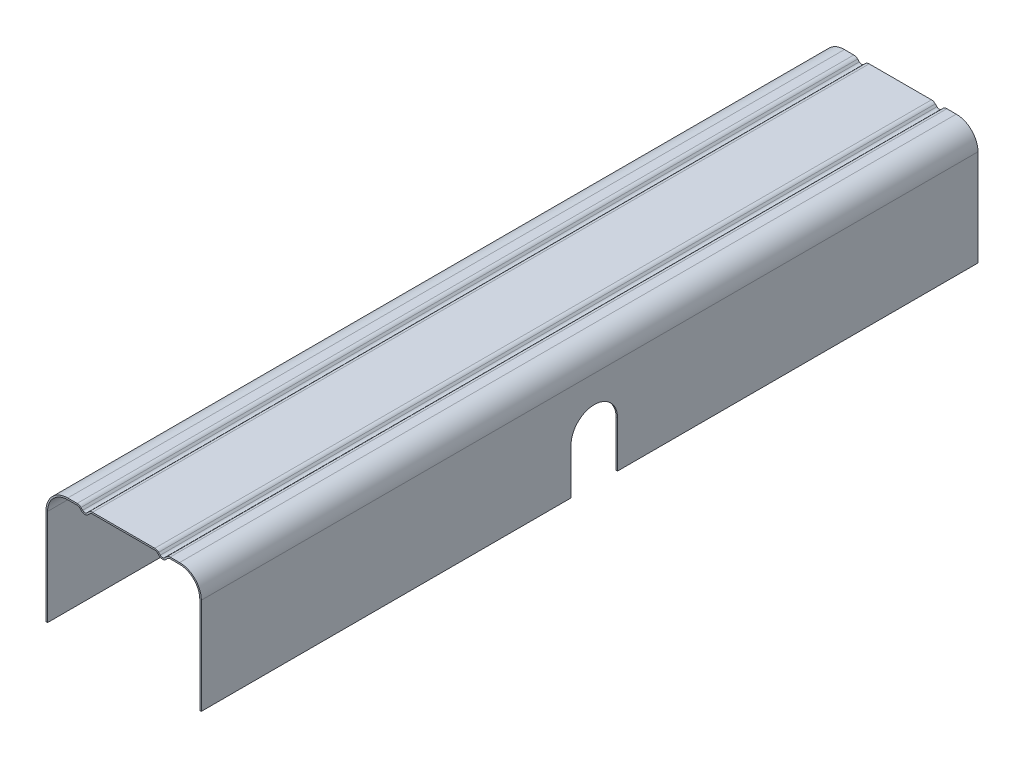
SolidWorks part; units mm, degrees
ref_plane "Plan1" through (0, 0, 0) normal (0, 0, 1) x (1, 0, 0)
ref_plane "Plan2" through (0, 0, 0) normal (0, 1, 0) x (1, 0, 0)
ref_plane "Plan3" through (0, 0, 0) normal (1, 0, 0) x (0, 0, -1)
sketch "Esquisse1" plane through (0, 0, 0) normal (0, 0, 1) x (1, 0, 0)
  line L7 (50, 39) -> (50, -50) construction
  line L8 (29.9497, 53) -> (36, 53) construction
  line L9 (26.4142, 50.9142) -> (27.4749, 51.9749) construction
  line L10 (22.5251, 51.9749) -> (23.5858, 50.9142) construction
  line L11 (-20.0503, 53) -> (20.0503, 53) construction
  line L12 (-23.5858, 50.9142) -> (-22.5251, 51.9749) construction
  line L13 (-27.4749, 51.9749) -> (-26.4142, 50.9142) construction
  line L14 (-36, 53) -> (-29.9497, 53) construction
  line L15 (-50, -50) -> (-50, 39) construction
  line L16 (50, 39) -> (50, -23)
  line L17 (29.9497, 53) -> (36, 53)
  line L18 (26.4142, 50.9142) -> (27.4749, 51.9749)
  line L19 (22.5251, 51.9749) -> (23.5858, 50.9142)
  line L20 (-20.0503, 53) -> (20.0503, 53)
  line L21 (-23.5858, 50.9142) -> (-22.5251, 51.9749)
  line L22 (-27.4749, 51.9749) -> (-26.4142, 50.9142)
  line L23 (-36, 53) -> (-29.9497, 53)
  line L24 (-50, -23) -> (-50, 39)
  arc A4 (50, 39) -> (36, 53) centre (36, 39) ccw construction
  arc A5 (29.9497, 53) -> (27.4749, 51.9749) centre (29.9497, 49.5) ccw construction
  arc A6 (23.5858, 50.9142) -> (26.4142, 50.9142) centre (25, 52.3284) ccw construction
  arc A7 (22.5251, 51.9749) -> (20.0503, 53) centre (20.0503, 49.5) ccw construction
  arc A8 (-20.0503, 53) -> (-22.5251, 51.9749) centre (-20.0503, 49.5) ccw construction
  arc A9 (-26.4142, 50.9142) -> (-23.5858, 50.9142) centre (-25, 52.3284) ccw construction
  arc A10 (-27.4749, 51.9749) -> (-29.9497, 53) centre (-29.9497, 49.5) ccw construction
  arc A11 (-36, 53) -> (-50, 39) centre (-36, 39) ccw construction
  arc A12 (50, 39) -> (36, 53) centre (36, 39) ccw
  arc A13 (29.9497, 53) -> (27.4749, 51.9749) centre (29.9497, 49.5) ccw
  arc A14 (23.5858, 50.9142) -> (26.4142, 50.9142) centre (25, 52.3284) ccw
  arc A15 (22.5251, 51.9749) -> (20.0503, 53) centre (20.0503, 49.5) ccw
  arc A16 (-20.0503, 53) -> (-22.5251, 51.9749) centre (-20.0503, 49.5) ccw
  arc A17 (-26.4142, 50.9142) -> (-23.5858, 50.9142) centre (-25, 52.3284) ccw
  arc A18 (-27.4749, 51.9749) -> (-29.9497, 53) centre (-29.9497, 49.5) ccw
  arc A19 (-36, 53) -> (-50, 39) centre (-36, 39) ccw
extrude "Base-Extru.-Mince" add sketch "Esquisse1" along normal blind 500 thin
sketch "Esquisse2" plane through (-50, 0, 0) normal (-1, 0, 0) x (0, 0, 1)
  line L0 (262, 6.5365) -> (262, -26.4641)
  line L1 (232, 6.5365) -> (232, -26.4641)
  line L3 (500, -26.4641) -> (0, -26.4641) construction
  line L4 (262, -26.4641) -> (232, -26.4641)
  arc A0 (262, 6.5365) -> (232, 6.5365) centre (247, 6.5365) ccw
  dimension "D1" = 15
extrude "Enlèv. mat.-Extru.1" cut sketch "Esquisse2" against normal through all
